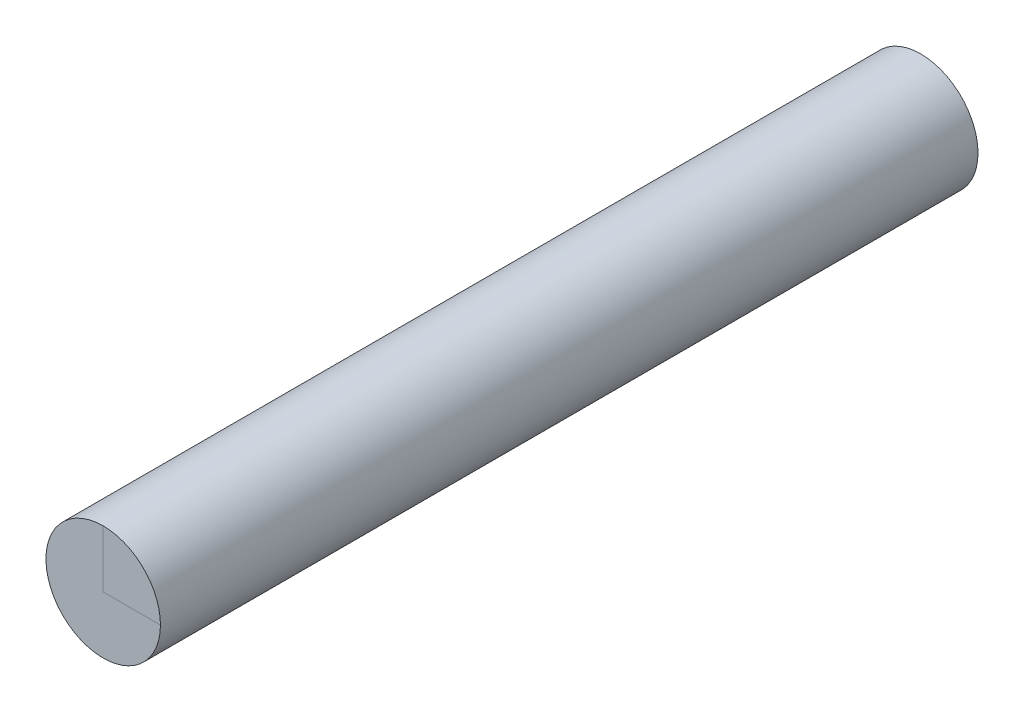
SolidWorks part; units mm, degrees
ref_plane "Front Plane" through (0, 0, 0) normal (0, 0, 1) x (1, 0, 0)
ref_plane "Top Plane" through (0, 0, 0) normal (0, 1, 0) x (1, 0, 0)
ref_plane "Right Plane" through (0, 0, 0) normal (1, 0, 0) x (0, 0, -1)
ref_plane "Plane1" through (0, 143.0609, 109.3995) normal (0, -0.7944, -0.6075) x (1, 0, 0)
sketch "Sketch1" plane through (0, 0, 531.9895) normal (0, 1, 0) x (1, 0, 0)
  line L0 (14.986, 745.9989) -> (0, 745.9989)
  line L1 (0, 745.9989) -> (0, 531.9895)
  line L2 (0, 531.9895) -> (14.986, 531.9895)
  line L3 (14.986, 531.9895) -> (14.986, 745.9989)
  line L4 (0, 667.0304) -> (0, 610.9581) construction
  line L5 (-16.4846, 531.9895) -> (16.4846, 531.9895) construction
  line L9 (0, 515.5049) -> (0, 548.4741) construction
  dimension "D1" = 14.986
revolve "Revolve1" add sketch "Sketch1" angle 360 about L4
sketch "Sketch2" plane through (0, 0, 0) normal (0, 0, 1) x (1, 0, 0)
  line L1 (0, 0) -> (24.3438, 0)
  line L2 (0, 0) -> (0, 23.1405)
  line L3 (0, 23.1405) -> (24.3438, 23.1405)
  line L4 (24.3438, 0) -> (24.3438, 23.1405)
